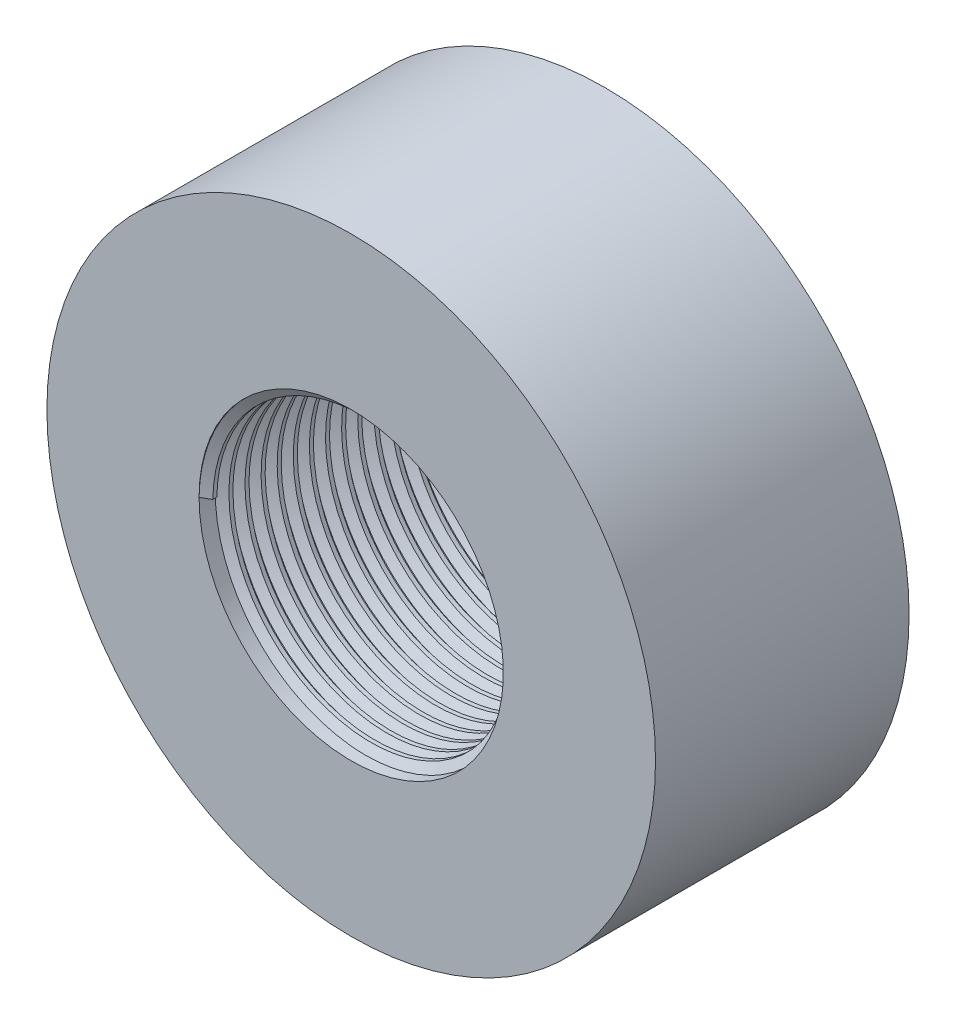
SolidWorks part; units mm, degrees
ref_plane "Front Plane" through (0, 0, 0) normal (0, 0, 1) x (1, 0, 0)
ref_plane "Top Plane" through (0, 0, 0) normal (0, 1, 0) x (1, 0, 0)
ref_plane "Right Plane" through (0, 0, 0) normal (1, 0, 0) x (0, 0, -1)
sketch "Sketch1" plane through (0, 0, 0) normal (0, 0, 1) x (1, 0, 0)
  circle A1 centre (0, 0) radius 6
  dimension "D2" = 12
extrude "Boss-Extrude1" add sketch "Sketch1" along normal mid plane 5
sketch "Sketch14" plane through (0, 0, 2.5) normal (0, 0, 1) x (1, 0, 0)
  circle A0 centre (0, 0) radius 3
  dimension "D1" = 6
extrude "Cut-Extrude1" cut sketch "Sketch14" against normal blind 5
thread "Thread1" pitch 0.3175 start angle 0, offset 0, length 5, pitch 0.3175, diameter 6
ref_plane "Plane5" through (-3, 0, 2.5) normal (0, -1, 0) x (-1, 0, 0)
sketch "Thread Profile5" plane through (-3, 0, 2.5) normal (0, -1, 0) x (-1, 0, 0)
  line L0 (0, 0) -> (0, 0.3175) construction
  line L11 (0, 0) -> (0, 0.2778)
  line L12 (0, 0.2778) -> (-0.1719, 0.1786)
  line L13 (-0.1719, 0.1786) -> (-0.1719, 0.0992)
  line L15 (-0.1719, 0.0992) -> (0, 0)
  line L17 (-0.1719, 0.1389) -> (0, 0.1389) construction
  point P2 (0, 0)
  dimension "Pitch" = 0.3175
  dimension "Profile_Angle" = 60
  dimension "Profile_Land" = 0.0794
  dimension "Profile_Height" = 0.1719
